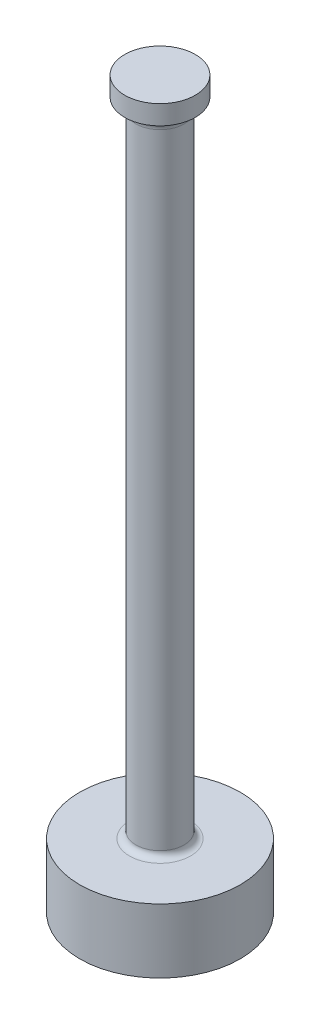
SolidWorks part; units mm, degrees
ref_plane "Front View" through (0, 0, 0) normal (0, 0, 1) x (1, 0, 0)
ref_plane "Upper View" through (0, 0, 0) normal (0, 1, 0) x (1, 0, 0)
ref_plane "Side View" through (0, 0, 0) normal (1, 0, 0) x (0, 0, -1)
sketch "Sketch1" plane through (0, 0, 0) normal (0, 1, 0) x (1, 0, 0)
  circle A0 centre (0, 0) radius 250
extrude "Boss-Extrude2" add sketch "Sketch1" along normal blind 200 contours A0
sketch "Sketch2" plane through (0, 200, 0) normal (0, 1, 0) x (1, 0, 0)
  circle A0 centre (0, 0) radius 75
extrude "Boss-Extrude3" add sketch "Sketch2" along normal blind 2000
fillet "Fillet1" radius 20 1 edges at (0, 200, 75)
sketch "Sketch3" plane through (0, 2200, 0) normal (0, 1, 0) x (1, 0, 0)
  circle A0 centre (0, 0) radius 110
extrude "Boss-Extrude4" add sketch "Sketch3" along normal blind 60
fillet "Fillet2" radius 35 1 edges at (0, 2200, 75)
